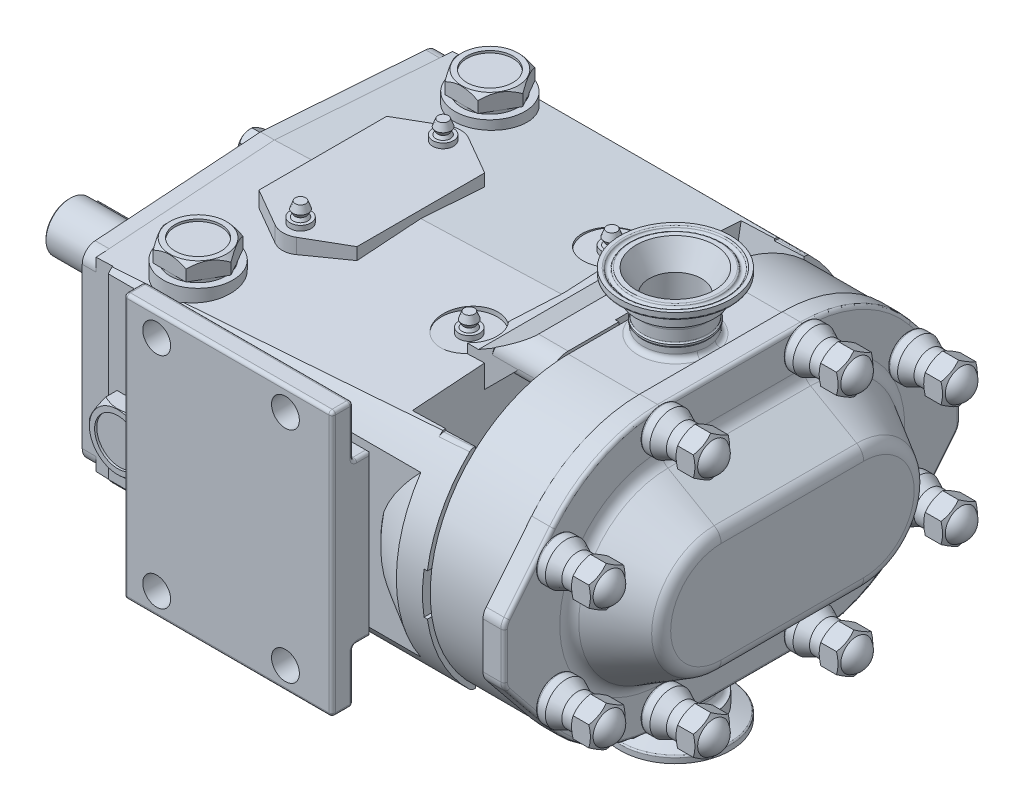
SolidWorks part; units mm, degrees
ref_plane "Front Plane" through (0, 0, 0) normal (0, 0, 1) x (1, 0, 0)
ref_plane "Top Plane" through (0, 0, 0) normal (0, 1, 0) x (1, 0, 0)
ref_plane "Right Plane" through (0, 0, 0) normal (1, 0, 0) x (0, 0, -1)
other "Join1"
other "grease fitting<3>@006_015_U2_Lower Shaft"
other "grease fitting<7>@006_015_U2_Lower Shaft"
other "cleanout plug<2>@006_015_U2_Lower Shaft"
other "cleanout plug<1>@006_015_U2_Lower Shaft"
other "grease fitting<6>@006_015_U2_Lower Shaft"
other "grease fitting<1>@006_015_U2_Lower Shaft"
other "oil plug<6>@006_015_U2_Lower Shaft"
other "oil plug<5>@006_015_U2_Lower Shaft"
other "oil plug<4>@006_015_U2_Lower Shaft"
other "oil plug<3>@006_015_U2_Lower Shaft"
other "oil plug<2>@006_015_U2_Lower Shaft"
other "Key<1>@006_015_U2_Lower Shaft"
other "Shaft<1>@006_015_U2_Lower Shaft"
other "oil plug<1>@006_015_U2_Lower Shaft"
other "108369<8>@006_015_U2_Lower Shaft"
other "108369<7>@006_015_U2_Lower Shaft"
other "108369<6>@006_015_U2_Lower Shaft"
other "108369<5>@006_015_U2_Lower Shaft"
other "108369<4>@006_015_U2_Lower Shaft"
other "108369<3>@006_015_U2_Lower Shaft"
other "108369<2>@006_015_U2_Lower Shaft"
other "108369<1>@006_015_U2_Lower Shaft"
other "101842<1>@006_015_U2_Lower Shaft"
other "015001000S<1>@006_015_U2_Lower Shaft"
other "020110000<1>@006_015_U2_Lower Shaft"
other "plate<1>@006_015_U2_Lower Shaft"
other "102276<1>@006_015_U2_Lower Shaft"
other "015360005<2>@006_015_U2_Lower Shaft"
other "015360005<1>@006_015_U2_Lower Shaft"
